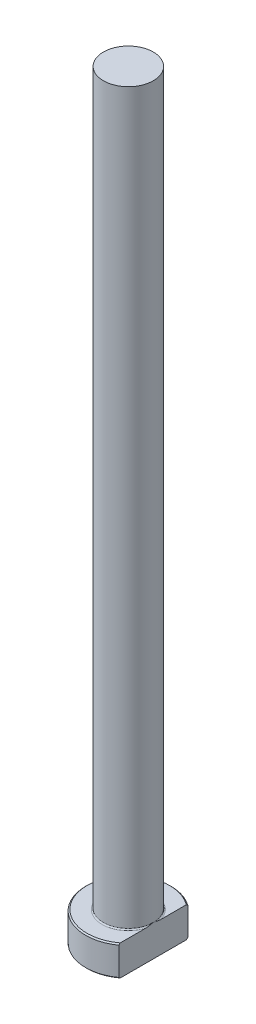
SolidWorks part; units mm, degrees
ref_plane "Front Plane" through (0, 0, 0) normal (0, 0, 1) x (1, 0, 0)
ref_plane "Top Plane" through (0, 0, 0) normal (0, 1, 0) x (1, 0, 0)
ref_plane "Right Plane" through (0, 0, 0) normal (1, 0, 0) x (0, 0, -1)
sketch "Sketch1" plane through (0, 0, 0) normal (0, 0, 1) x (1, 0, 0)
  line L0 (0, 259.9588) -> (0, -15.1925) construction
  line L1 (0, 0) -> (-7, 0)
  line L2 (-7, 0) -> (-7, 5)
  line L3 (-7, 5) -> (-4.1, 5)
  line L4 (-4.1, 5) -> (-4.1, 125)
  line L5 (-4.1, 125) -> (0, 125)
  line L6 (0, 125) -> (0, 0)
  dimension "L" = 125
  dimension "H" = 14
  dimension "T" = 5
  dimension "D" = 8.2
revolve "Revolve1" add sketch "Sketch1" angle 360 about L0
chamfer "Chamfer1" distance 0.2 angle 45 2 edges at (0, 5, 7) (0, 0, 7)
fillet "Fillet1" radius 0.2 1 edges at (0, 5, 4.1)
sketch "Sketch2" plane through (0, 0, 0) normal (0, 1, 0) x (1, 0, 0)
  line L0 (4.1, 5.6736) -> (4.1, -5.6736)
  circle A0 centre (0, 0) radius 7 construction
  arc A1 (4.1, -5.6736) -> (4.1, 5.6736) centre (0, 0) ccw
  circle A2 centre (0, 0) radius 4.1 construction
extrude "KEY" cut sketch "Sketch2" along normal through all
